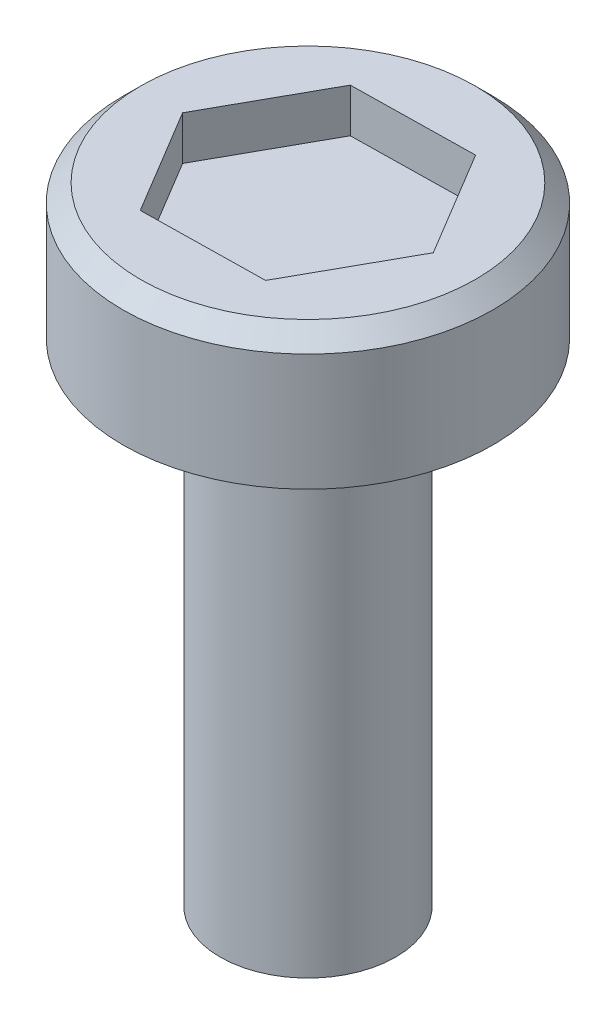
SolidWorks part; units mm, degrees
ref_plane "Front" through (0, 0, 0) normal (0, 0, 1) x (1, 0, 0)
ref_plane "Top" through (0, 0, 0) normal (0, 1, 0) x (1, 0, 0)
ref_plane "Right" through (0, 0, 0) normal (1, 0, 0) x (0, 0, -1)
sketch "Sketch1" plane through (0, 0, 0) normal (0, 0, 1) x (1, 0, 0)
  line L0 (0, 0) -> (10, 0)
  line L1 (10, 0) -> (10, 56.0531)
  line L2 (10, 56.0531) -> (21.0772, 56.0531)
  line L3 (21.0772, 56.0531) -> (21.0772, 71.3792)
  line L4 (21.0772, 71.3792) -> (0, 71.3792)
  line L5 (0, 71.3792) -> (0, 0)
  dimension "D1" = 10
revolve "Revolve1" add sketch "Sketch1" angle 360 about L5
chamfer "Chamfer1" distance 2 angle 45 1 edges at (0, 71.3792, 21.0772)
sketch "Sketch2" plane through (0, 71.3792, 0) normal (0, 1, 0) x (-1, 0, 0)
  line L1 (-6.8185, -12.2764) -> (7.2224, -12.0432)
  line L2 (7.2224, -12.0432) -> (14.0409, 0.2332)
  line L3 (14.0409, 0.2332) -> (6.8185, 12.2764)
  line L4 (6.8185, 12.2764) -> (-7.2224, 12.0432)
  line L5 (-7.2224, 12.0432) -> (-14.0409, -0.2332)
  line L6 (-14.0409, -0.2332) -> (-6.8185, -12.2764)
  circle A0 centre (0, 0) radius 12.1614 construction
extrude "Cut-Extrude1" cut sketch "Sketch2" against normal blind 5
